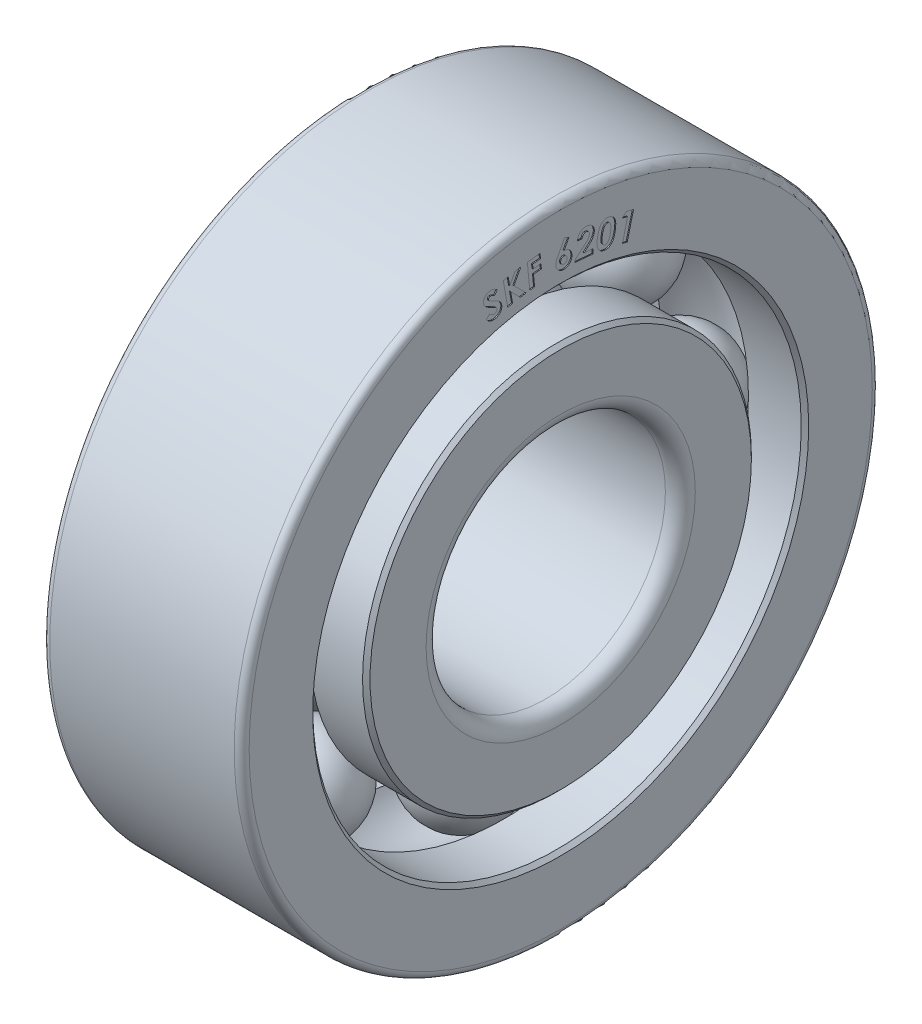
SolidWorks part; units mm, degrees
ref_plane "Front Plane" through (0, 0, 0) normal (0, 0, 1) x (1, 0, 0)
ref_plane "Top Plane" through (0, 0, 0) normal (0, 1, 0) x (1, 0, 0)
ref_plane "Right Plane" through (0, 0, 0) normal (1, 0, 0) x (0, 0, -1)
sketch "Sketch1" plane through (0, 0, 0) normal (0, 0, 1) x (1, 0, 0)
  line L0 (0, 0) -> (-11.9599, 0) construction
  line L1 (-9.8125, 9.75) -> (-7.1651, 9.75)
  line L2 (-0.75, 6) -> (-9.25, 6)
  line L3 (0, 6.75) -> (0, 9.5625)
  line L4 (-0.375, 16) -> (-9.625, 16)
  line L5 (-10, 6.75) -> (-10, 9.5625)
  line L6 (-9.8125, 12.25) -> (-7.1651, 12.25)
  line L7 (0, 12.4375) -> (0, 15.625)
  line L8 (-2.8349, 12.25) -> (-0.1875, 12.25)
  line L9 (-2.8349, 9.75) -> (-0.1875, 9.75)
  line L10 (-10, 12.4375) -> (-10, 15.625)
  line L11 (-9.8125, 12.25) -> (-10, 12.4375)
  line L12 (-10, 9.5625) -> (-9.8125, 9.75)
  line L13 (-0.1875, 9.75) -> (0, 9.5625)
  line L14 (-0.1875, 12.25) -> (0, 12.4375)
  arc A0 (-2.8349, 12.25) -> (-7.1651, 12.25) centre (-5, 11) ccw
  arc A1 (-7.1651, 9.75) -> (-2.8349, 9.75) centre (-5, 11) ccw
  arc A2 (-9.625, 16) -> (-10, 15.625) centre (-9.625, 15.625) ccw
  arc A3 (0, 15.625) -> (-0.375, 16) centre (-0.375, 15.625) ccw
  arc A4 (-9.25, 6) -> (-10, 6.75) centre (-9.25, 6.75) cw
  arc A5 (0, 6.75) -> (-0.75, 6) centre (-0.75, 6.75) cw
  point P12 (0, 9.75)
  point P13 (0, 12.25)
  point P16 (-10, 9.75)
  point P17 (-10, 12.25)
  point P18 (-10, 16)
  point P21 (0, 16)
  point P24 (-10, 6)
  dimension "D4" = 2.5
  dimension "D10" = 0.375
  dimension "D11" = 0.75
  dimension "D1" = 6
  dimension "D2" = 10
  dimension "D3" = 10
  dimension "D5" = 16
  dimension "D6" = 5
  dimension "D7" = 3.75
  dimension "D8" = 3.75
  dimension "D9" = 11
revolve "Revolve1" add sketch "Sketch1" angle 360 about L0
sketch "Sketch2" plane through (0, 0, 0) normal (0, 0, 1) x (1, 0, 0)
  line L0 (-5, 13.5) -> (-5, 8.5)
  arc A0 (-5, 8.5) -> (-5, 13.5) centre (-5, 11) ccw
  dimension "D1" = 5
  dimension "D2" = 11
  dimension "D3" = 5
revolve "Revolve2" add sketch "Sketch2" angle 360 about L0
pattern_circular "CirPattern1" count 8 over 360 about axis through (0, 0, 0) along (1, 0, 0)
sketch "Sketch7" plane through (0, 0, 0) normal (1, 0, 0) x (0, 0, -1)
  line L0 (0, 0) -> (0, 13) construction
  line L1 (0, 0) -> (-6.5, 11.2583) construction
  line L2 (0, 0) -> (6.5, 11.2583) construction
  arc A0 (6.5, 11.2583) -> (-6.5, 11.2583) centre (0, 0) ccw construction
  text T0 "SKF 6201" font "Century Gothic" height 1.3
  dimension "D1" = 26
  dimension "D2" = 30
wrap "Wrap1" sketch "Sketch7" wrap type deboss source sketch "Sketch7" thickness 0.05 parameters "D1"=0.05
ref_plane "Plane1" through (-0.5, 0, 0) normal (1, 0, 0) x (0, 0, -1)
